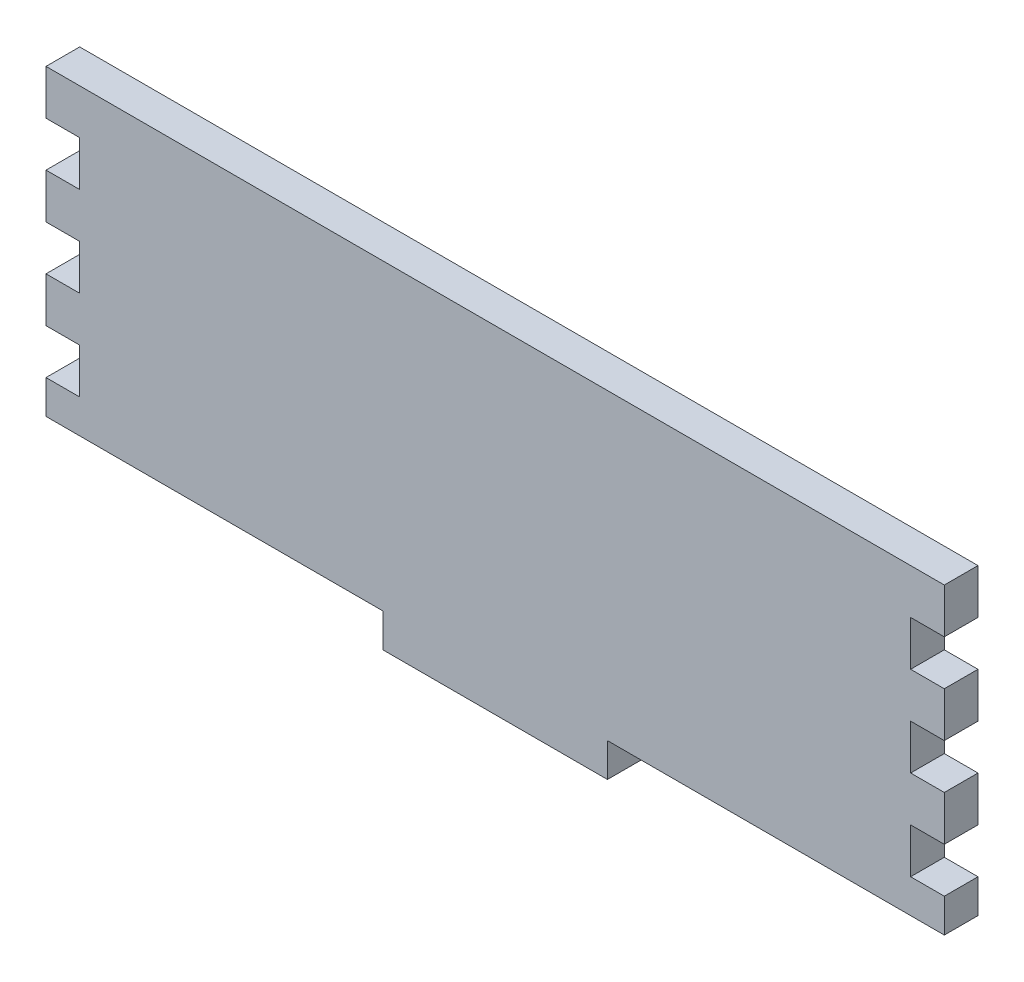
SolidWorks part; units mm, degrees
ref_plane "Alzado" through (0, 0, 0) normal (0, 0, 1) x (1, 0, 0)
ref_plane "Planta" through (0, 0, 0) normal (0, 1, 0) x (1, 0, 0)
ref_plane "Vista lateral" through (0, 0, 0) normal (1, 0, 0) x (0, 0, -1)
sketch "Croquis1" plane through (0, 0, 0) normal (0, 0, 1) x (1, 0, 0)
  line L0 (-200, -60) -> (-50, -60)
  line L1 (200, -75) -> (-200, -75) construction
  line L2 (200, -60) -> (200, 75)
  line L3 (200, 75) -> (-200, 75)
  line L4 (-200, -60) -> (-200, 75)
  line L5 (200, -75) -> (-200, 75) construction
  line L6 (200, 75) -> (-200, -75) construction
  line L7 (-50, -60) -> (-50, -75)
  line L8 (-50, -75) -> (50, -75)
  line L9 (50, -75) -> (50, -60)
  line L10 (50, -60) -> (200, -60)
  line L11 (-200, -60) -> (-200, -75) construction
  line L12 (200, -75) -> (200, -60) construction
  point P0 (0, 0)
  point P8 (0, -75)
extrude "Saliente-Extruir1" add sketch "Croquis1" along normal blind 15
sketch "Croquis2" plane through (0, 0, 15) normal (0, 0, 1) x (1, 0, 0)
  line L0 (-200, 55) -> (-185, 55)
  line L1 (-200, 75) -> (-200, -60) construction
  line L2 (-185, 55) -> (-185, 35)
  line L3 (-185, 35) -> (-200, 35)
  line L4 (-200, 35) -> (-200, 55)
  line L5 (200, 75) -> (-200, 75) construction
  line L6 (-200, 15) -> (-185, 15)
  line L7 (-185, 15) -> (-185, -5)
  line L8 (-185, -5) -> (-200, -5)
  line L9 (-200, -5) -> (-200, 15)
  line L10 (-200, -25) -> (-185, -25)
  line L11 (-185, -25) -> (-185, -45)
  line L12 (-185, -45) -> (-200, -45)
  line L13 (-200, -45) -> (-200, -25)
  line L15 (0, 0) -> (0, 75) construction
  line L16 (200, -45) -> (200, -25)
  line L17 (185, -45) -> (200, -45)
  line L18 (185, -25) -> (185, -45)
  line L19 (200, -25) -> (185, -25)
  line L20 (200, -5) -> (200, 15)
  line L21 (185, -5) -> (200, -5)
  line L22 (185, 15) -> (185, -5)
  line L23 (200, 15) -> (185, 15)
  line L24 (200, 35) -> (200, 55)
  line L25 (185, 35) -> (200, 35)
  line L26 (185, 55) -> (185, 35)
  line L27 (200, 55) -> (185, 55)
extrude "Cortar-Extruir1" cut sketch "Croquis2" against normal through all
equation "\"D1@Croquis1\" = \"altura\""
equation "\"profbase\"= 400"
equation "\"anchbase\"= 400"
equation "\"thicknes\"=15"
equation "\"altura\"=150"
equation "\"D1@Saliente-Extruir1\"=\"thicknes\""
equation "\"D2@Croquis1\"=\"profbase\""
equation "\"clearens\"=0"
equation "\"joind1\"=100"
equation "\"D3@Croquis1\"=\"thicknes\""
equation "\"D4@Croquis1\"=\"joind1\""
equation "\"D1@Croquis2\"=\"thicknes\""
